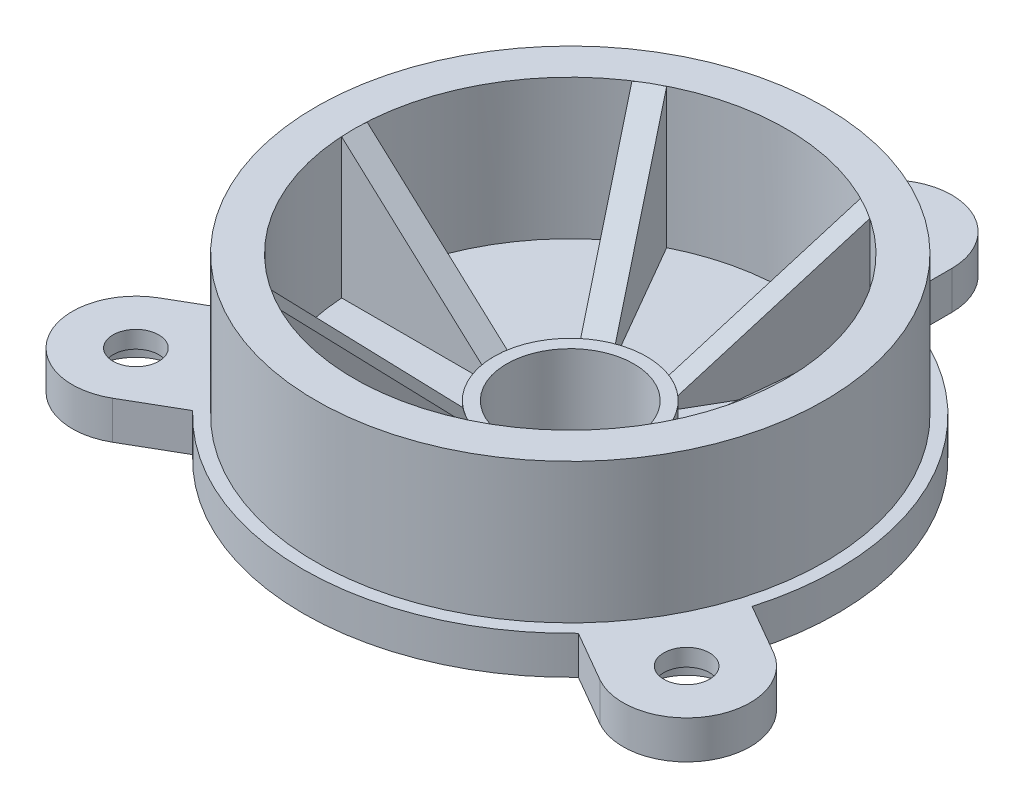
SolidWorks part; units mm, degrees
ref_plane "Front Plane" through (0, 0, 0) normal (0, 0, 1) x (1, 0, 0)
ref_plane "Top Plane" through (0, 0, 0) normal (0, 1, 0) x (1, 0, 0)
ref_plane "Right Plane" through (0, 0, 0) normal (1, 0, 0) x (0, 0, -1)
sketch "Sketch1" plane through (0, 0, 0) normal (1, 0, 0) x (0, 0, -1)
  line L0 (0, 0) -> (0, 17.8779) construction
  line L1 (6, 6) -> (5, 6)
  line L2 (5, 6) -> (5, 0)
  line L3 (5, 0) -> (10, 0)
  line L4 (10, 0) -> (10, 2)
  line L5 (10, 2) -> (21, 2)
  line L6 (21, 2) -> (21, 5)
  line L7 (21, 5) -> (20, 5)
  line L8 (20, 5) -> (20, 16)
  line L9 (20, 16) -> (17, 16)
  line L10 (17, 16) -> (17, 5)
  line L11 (17, 5) -> (6, 5)
  line L12 (6, 5) -> (6, 6)
  dimension "D1" = 10
  dimension "D2" = 20
  dimension "D3" = 42
  dimension "D4" = 40
  dimension "D5" = 34
  dimension "D6" = 2
  dimension "D7" = 3
  dimension "D8" = 1
  dimension "D9" = 12
  dimension "D10" = 11
revolve "Revolve1" add sketch "Sketch1" angle 360 about L0
sketch "Sketch2" plane through (0, 5, 0) normal (0, 1, 0) x (1, 0, 0)
  line L4 (0, 0) -> (0, 32.9529) construction
  line L5 (5, 25) -> (5, 19.3649)
  line L6 (-5, 19.3649) -> (-5, 25)
  arc A1 (15.9058, 19.2875) -> (-17.5785, 17.7763) centre (0, 0) ccw construction
  arc A5 (-5, 25) -> (5, 25) centre (0, 25) cw
  circle A6 centre (0, 0) radius 20 construction
  arc A7 (5, 19.3649) -> (-5, 19.3649) centre (0, 0) ccw
  dimension "D1" = 25
  dimension "D2" = 5
extrude "Boss-Extrude1" add sketch "Sketch2" against normal up to surface (3 mm away)
hole_wizard "CBORE for M3 SBHCS1" positions "Sketch3" profile "Sketch4" counterbore size "M3" standard "ANSI Metric"
sketch "Sketch3" plane through (0, 2, 0) normal (0, -1, 0) x (-1, 0, 0)
  point P0 (0, 25)
sketch "Sketch4" plane through (0, 2, -25) normal (1, 0, 0) x (0, 0, -1)
  line L0 (0, 0) -> (0, 14)
  line L1 (0, 14) -> (1.8, 14)
  line L3 (1.8, 14) -> (1.8, 1.65)
  line L4 (1.8, 1.65) -> (3.35, 1.65)
  line L5 (3.35, 1.65) -> (3.35, 0)
  line L7 (3.35, 0) -> (0, 0)
  line L11 (0, -6.35) -> (0, 107.95) construction
  dimension "Thru Hole Dia." = 3.6
  dimension "Thru Hole Depth" = 14
  dimension "C'Bore Dia." = 6.7
  dimension "C'Bore Depth" = 1.65
pattern_circular "CirPattern1" count 6 over 360 about axis through (0, 2, 0) along (0, -1, 0) of "Boss-Extrude1", "CBORE for M3 SBHCS1"
sketch "Sketch5" plane through (0, 0, 0) normal (0, 0, 1) x (1, 0, 0)
  line L0 (-6, 6) -> (-17, 16)
rib "Rib1" sketch "Sketch5" sketch "Sketch5" thickness 2 extrusion direction parallel to sketch draft on no parameters "D1"=2
pattern_circular "CirPattern2" count 6 over 360 about axis through (0, 0, 0) along (0, 1, 0) of "Rib1"
